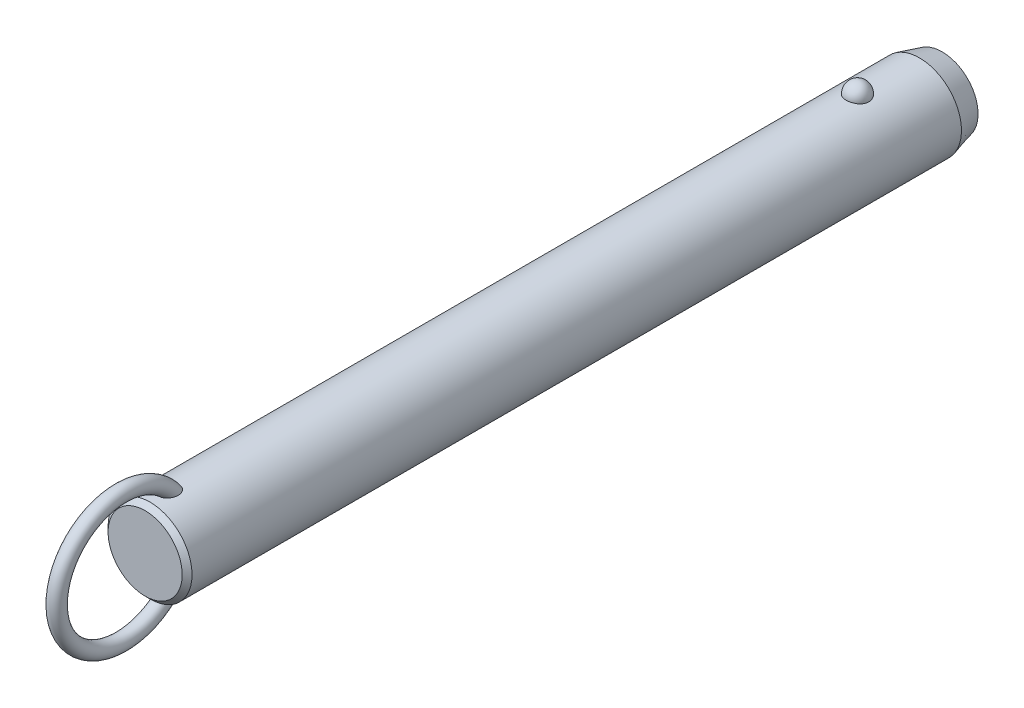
SolidWorks part; units mm, degrees
ref_plane "Front Plane" through (0, 0, 0) normal (0, 0, 1) x (1, 0, 0)
ref_plane "Top Plane" through (0, 0, 0) normal (0, 1, 0) x (1, 0, 0)
ref_plane "Right Plane" through (0, 0, 0) normal (1, 0, 0) x (0, 0, -1)
sketch "Sketch2" plane through (0, 0, 0) normal (0, 0, 1) x (1, 0, 0)
  circle A0 centre (0, 0) radius 11.1
  point P3 (0, 11.1)
  dimension "D1" = 22.2
extrude "Boss-Extrude1" add sketch "Sketch2" along normal blind 172.7
sketch "Sketch3" plane through (0, 0, 0) normal (0, 0, -1) x (-1, 0, 0)
  circle A0 centre (0, 0) radius 11.1
  dimension "D1" = 22.2
extrude "Boss-Extrude2" add sketch "Sketch3" along normal blind 25.4
chamfer "Chamfer1" distance 6 angle 15 1 edges at (-11.1, 0, -25.4)
sketch "Sketch12" plane through (0, 0, 0) normal (1, 0, 0) x (0, 0, -1)
  line L0 (-172.7, 11.1) -> (-172.7, -11.1) construction
  point P0 (-172.7, 0)
sketch "Sketch13" plane through (0, 0, 0) normal (1, 0, 0) x (0, 0, -1)
  circle A0 centre (-191.75, 0) radius 19.05
  point P2 (-172.7, 0)
  dimension "D1" = 38.1
sketch "Sketch14" plane through (0, 0, 0) normal (0, 1, 0) x (1, 0, 0)
  circle A0 centre (0, -174.7) radius 2
  point P2 (0, -172.7)
  dimension "D1" = 4
sweep "Sweep1" add profiles "Sketch14" path "Sketch13"
sketch "Sketch15" plane through (0, 0, 172.7) normal (0, 0, 1) x (1, 0, 0)
  circle A0 centre (0, 0) radius 11.1
  dimension "D1" = 22.2
extrude "Boss-Extrude3" add sketch "Sketch15" along normal blind 12.7
chamfer "Chamfer2" distance 1.3 angle 45 1 edges at (11.1, 0, 185.4)
sketch "Sketch18" plane through (0, 0, 0) normal (1, 0, 0) x (0, 0, -1)
  line L0 (19.4, 11.1) -> (-176.268, 11.1) construction
  line L1 (3, 14.1) -> (3, 8.1)
  line L2 (-176.268, -11.1) -> (19.4, -11.1) construction
  arc A0 (3, 14.1) -> (3, 8.1) centre (3, 11.1) ccw
  point P4 (0, 11.1)
  dimension "D1" = 25.2
revolve "Revolve1" add sketch "Sketch18" angle 360 about L1
